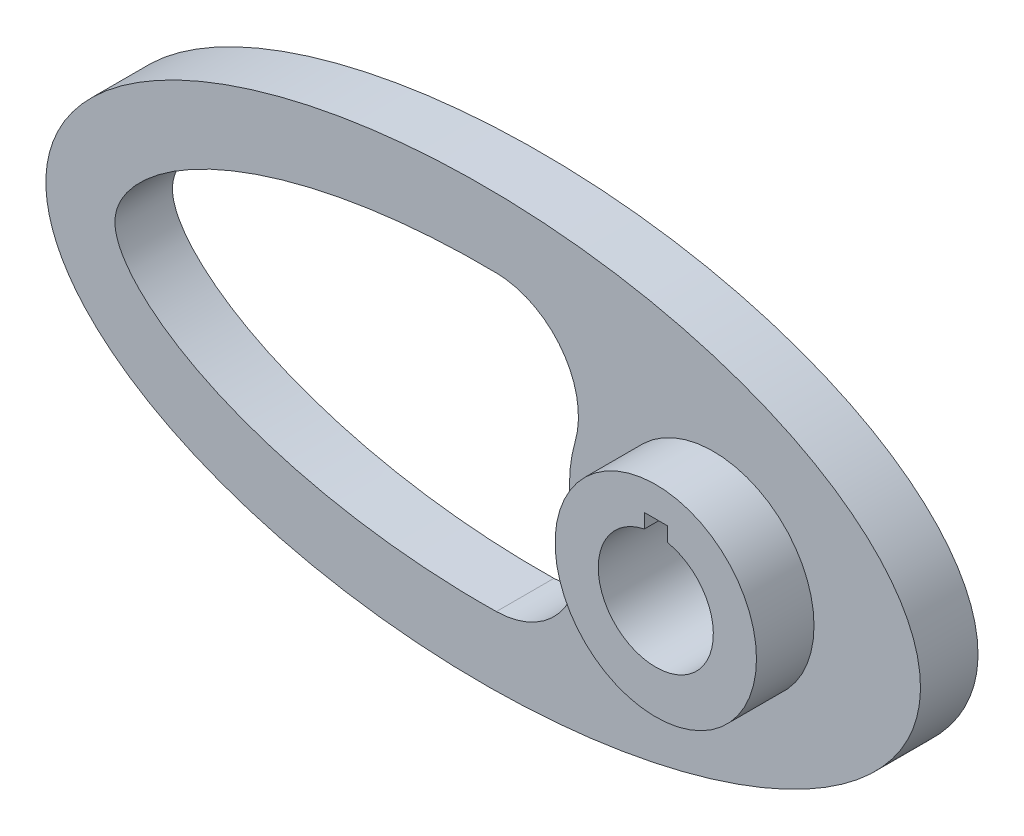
SolidWorks part; units mm, degrees
ref_plane "Front Plane" through (0, 0, 0) normal (0, 0, 1) x (1, 0, 0)
ref_plane "Top Plane" through (0, 0, 0) normal (0, 1, 0) x (1, 0, 0)
ref_plane "Right Plane" through (0, 0, 0) normal (1, 0, 0) x (0, 0, -1)
sketch "Sketch1" plane through (0, 0, 0) normal (0, 0, 1) x (1, 0, 0)
  line L0 (0, 0) -> (76, 0) construction
  ellipse E0 centre (0, 0) end of major axis (-76, 0) minor radius 37.5
  dimension "D1" = 152
  dimension "D2" = 75
extrude "Boss-Extrude1" add sketch "Sketch1" along normal blind 10
sketch "Sketch2" plane through (0, 0, 10) normal (0, 0, 1) x (1, 0, 0)
  line L0 (0, 0) -> (76, 0) construction
  circle A0 centre (40, 0) radius 17.5
  dimension "D2" = 35
  dimension "D1" = 40
extrude "Boss-Extrude2" add sketch "Sketch2" along normal blind 10
sketch "Sketch3" plane through (0, 0, 10) normal (0, 0, 1) x (1, 0, 0)
  arc A0 (15.9859, 6.9515) -> (15.9859, -6.9515) centre (40, 0) ccw
  arc A1 (2.2914, -25.4816) -> (15.9859, -6.9515) centre (2.0578, -10.9834) ccw
  arc A2 (15.9859, 6.9515) -> (2.2914, 25.4816) centre (2.0578, 10.9834) ccw
  spline S0 degree 3 number of poles 143 (-64, 0) -> (-64, 0)
  spline S1 degree 3 number of poles 75 (2.2914, 25.4816) -> (2.2914, -25.4816)
  dimension "D2" = 25
  dimension "D3" = 14.5
  dimension "D1" = 12
extrude "Cut-Extrude1" cut sketch "Sketch3" against normal through all
sketch "Sketch4" plane through (0, 0, 10) normal (0, 0, 1) x (1, 0, 0)
  spline S0 degree 3 number of poles 151 (-70, 0) -> (-70, 0)
  spline S1 degree 3 number of poles 151 (-70, 0) -> (-70, 0)
  dimension "D1" = 6
sketch "Sketch7" plane through (0, 0, 20) normal (0, 0, 1) x (1, 0, 0)
  line L0 (40, 0) -> (40, -10) construction
  line L1 (38, 9.798) -> (38, 12.298)
  line L2 (38, 12.298) -> (42, 12.298)
  line L3 (42, 12.298) -> (42, 9.798)
  arc A0 (38, 9.798) -> (42, 9.798) centre (40, 0) ccw
  dimension "D3" = 20
  dimension "D1" = 2.5
  dimension "D2" = 4
extrude "Cut-Extrude2" cut sketch "Sketch7" against normal through all
